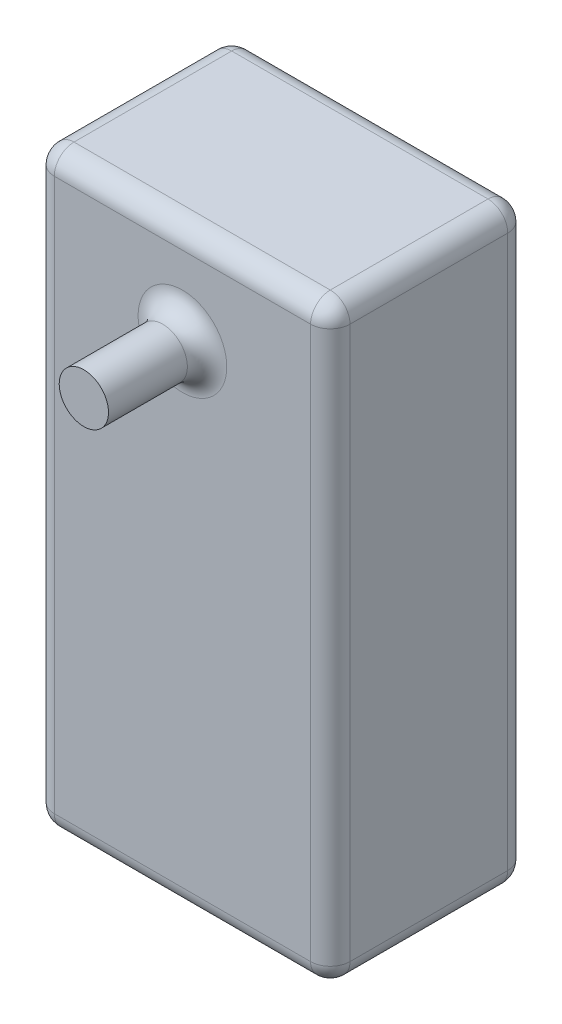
SolidWorks part; units mm, degrees
ref_plane "Plan de face" through (0, 0, 0) normal (0, 0, 1) x (1, 0, 0)
ref_plane "Plan de dessus" through (0, 0, 0) normal (0, 1, 0) x (1, 0, 0)
ref_plane "Plan de droite" through (0, 0, 0) normal (1, 0, 0) x (0, 0, -1)
sketch "Esquisse1" plane through (0, 0, 0) normal (0, 0, 1) x (1, 0, 0)
  line L0 (0, 0) -> (30, 0)
  line L1 (0, 0) -> (0, 60)
  line L2 (30, 0) -> (30, 60)
  line L3 (0, 60) -> (30, 60)
  dimension "D1" = 60
  dimension "D2" = 30
extrude "Boss.-Extru.1" add sketch "Esquisse1" along normal blind 20
sketch "Esquisse2" plane through (0, 0, 20) normal (0, 0, 1) x (1, 0, 0)
  line L0 (30, 60) -> (0, 60) construction
  line L1 (30, 0) -> (30, 60) construction
  circle A0 centre (15, 50) radius 2.5
  dimension "D1" = 5
  dimension "D2" = 10
  dimension "D3" = 15
extrude "Boss.-Extru.2" add sketch "Esquisse2" along normal blind 10
fillet "Congé2" radius 2 13 edges at (30, 60, 10) (30, 0, 10) (0, 60, 10) (0, 0, 10) (15, 60, 20) (30, 30, 20) (15, 0, 20) (0, 30, 20) (12.5, 50, 20) (15, 0, 0) (30, 30, 0) (15, 60, 0) (0, 30, 0)
